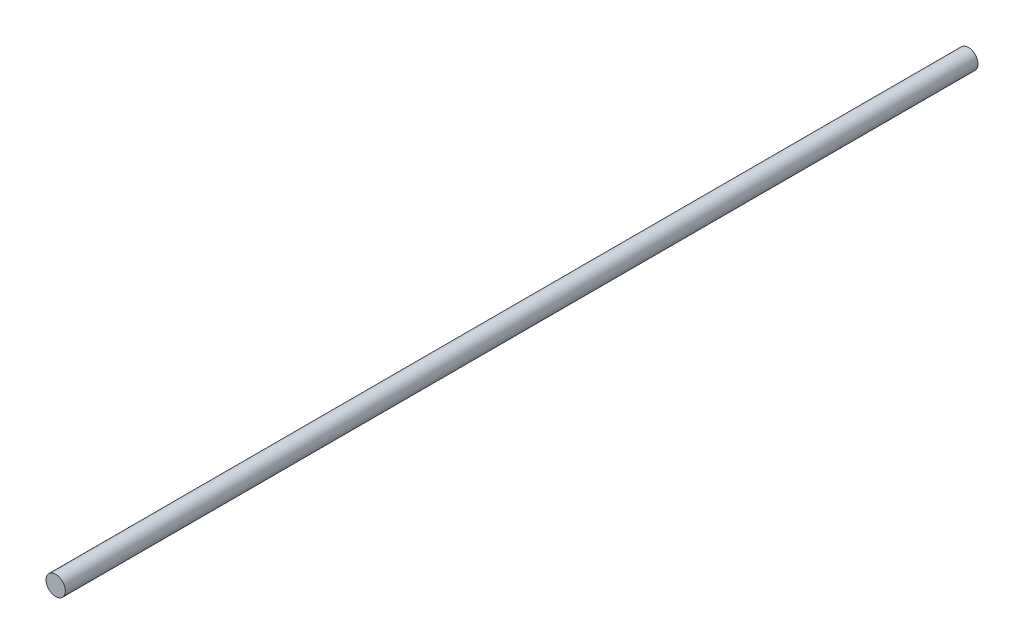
SolidWorks part; units mm, degrees
ref_plane "前视基准面" through (0, 0, 0) normal (0, 0, 1) x (1, 0, 0)
ref_plane "上视基准面" through (0, 0, 0) normal (0, 1, 0) x (1, 0, 0)
ref_plane "右视基准面" through (0, 0, 0) normal (1, 0, 0) x (0, 0, -1)
sketch "草图1" plane through (0, 0, 0) normal (0, 0, 1) x (1, 0, 0)
  circle A0 centre (0, 0) radius 4
  dimension "D1" = 8
extrude "凸台-拉伸1" add sketch "草图1" along normal mid plane 377
